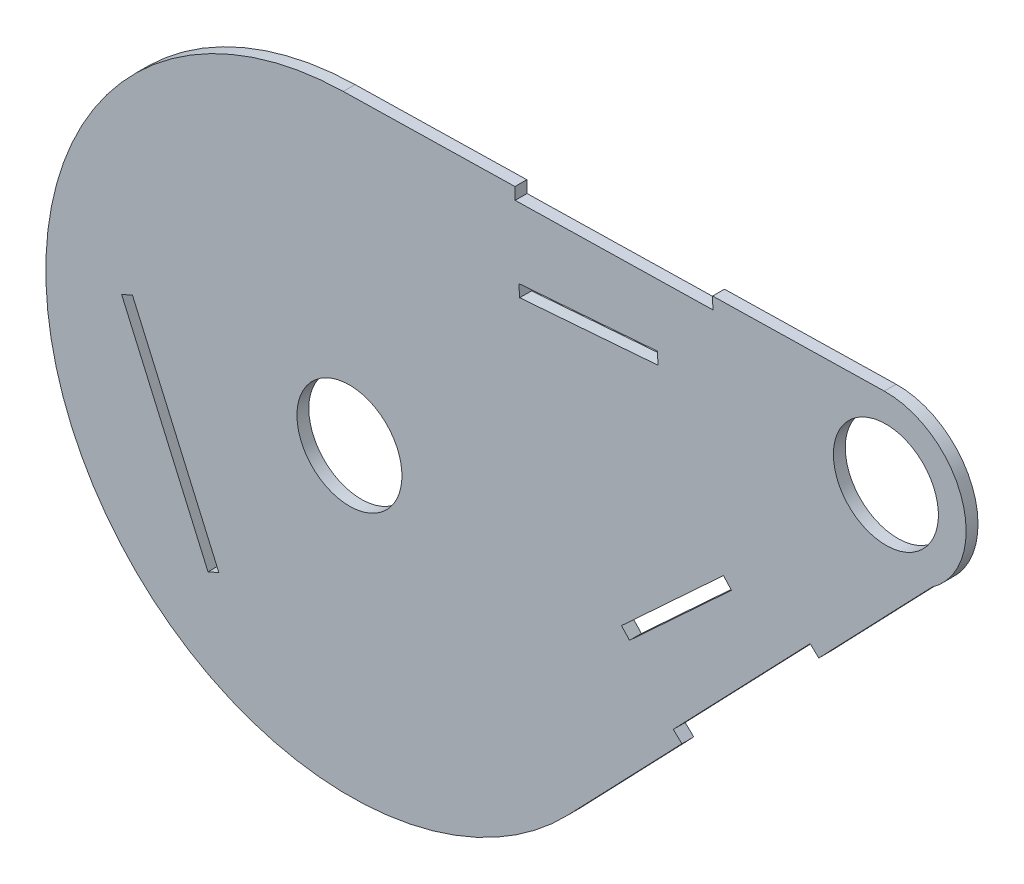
SolidWorks part; units mm, degrees
ref_plane "Front Plane" through (0, 0, 0) normal (0, 0, 1) x (1, 0, 0)
ref_plane "Top Plane" through (0, 0, 0) normal (0, 1, 0) x (1, 0, 0)
ref_plane "Right Plane" through (0, 0, 0) normal (1, 0, 0) x (0, 0, -1)
sketch "Sketch1" plane through (0, 0, 0) normal (0, 0, 1) x (1, 0, 0)
  line L0 (15.4025, -13.3349) -> (-31.3049, -62.0177)
  line L1 (9.2589, 5.4018) -> (-60.2461, 3.9885)
  line L2 (-37.5826, -7.6299) -> (-37.7001, -6.1105)
  line L3 (9.4685, -4.905) -> (-59.4531, -35.0117) construction
  line L4 (-11.4029, -25.4543) -> (-24.5028, -37.5727)
  line L5 (-10.368, -26.573) -> (-23.4679, -38.6914)
  line L6 (-11.4029, -25.4543) -> (-10.368, -26.573)
  line L7 (-24.5028, -37.5727) -> (-23.4679, -38.6914)
  line L8 (-19.7901, -6.2537) -> (-19.9077, -4.7343)
  line L9 (-19.9077, -4.7343) -> (-37.7001, -6.1105)
  line L10 (-19.7901, -6.2537) -> (-37.5826, -7.6299)
  line L11 (-59.4531, -35.0117) -> (-95.1781, -50.6757) construction
  line L12 (-88.7234, -32.8297) -> (-77.6223, -58.1481)
  line L13 (-87.3276, -32.2178) -> (-76.2265, -57.5361)
  line L14 (-88.7234, -32.8297) -> (-87.3276, -32.2178)
  line L15 (-77.6223, -58.1481) -> (-76.2265, -57.5361)
  circle A0 centre (9.4685, -4.905) radius 6.7437
  arc A1 (15.4025, -13.3349) -> (9.2589, 5.4018) centre (9.4685, -4.905) ccw
  arc A2 (-60.2461, 3.9885) -> (-31.3049, -62.0177) centre (-59.4531, -35.0117) ccw
  circle A3 centre (-59.4531, -35.0117) radius 6.7437
  dimension "D1" = 90
extrude "Boss-Extrude1" add sketch "Sketch1" along normal blind 1.524
sketch "Sketch3" plane through (0, 0, 1.524) normal (0, 0, 1) x (1, 0, 0)
  line L0 (9.4685, -4.905) -> (-59.4531, -35.0117) construction
  line L2 (0.8412, -28.512) -> (-0.2585, -27.4569)
  line L3 (-16.7436, -46.8405) -> (-17.8433, -45.7855)
  line L4 (0.8412, -28.512) -> (-16.7436, -46.8405)
  line L5 (-0.2585, -27.4569) -> (-17.8433, -45.7855)
  line L6 (-25.4936, 4.6952) -> (-25.4626, 3.1715) construction
  line L9 (9.2589, 5.4018) -> (-60.2461, 3.9885) construction
  line L11 (-38.191, 4.437) -> (-38.16, 2.9133)
  line L12 (-12.7962, 4.9534) -> (-12.7652, 3.4297)
  line L13 (-38.191, 4.437) -> (-12.7962, 4.9534)
  line L14 (-38.16, 2.9133) -> (-12.7652, 3.4297)
extrude "Cut-Extrude1" cut sketch "Sketch3" against normal blind 1.524
